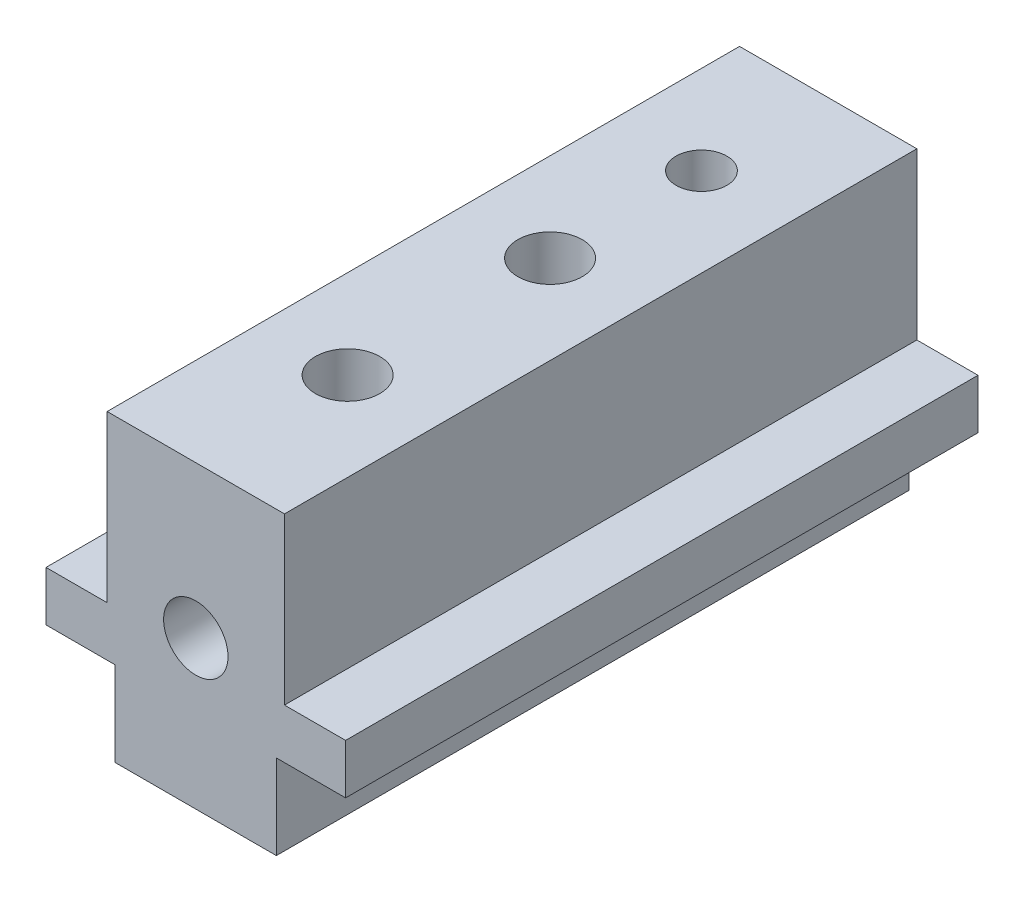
SolidWorks part; units mm, degrees
ref_plane "Front/Back" through (0, 0, 0) normal (0, 0, 1) x (1, 0, 0)
ref_plane "Top/Bottom" through (0, 0, 0) normal (0, 1, 0) x (1, 0, 0)
ref_plane "Right/Left" through (0, 0, 0) normal (1, 0, 0) x (0, 0, -1)
sketch "Sketch1" plane through (0, 0, 0) normal (0, 1, 0) x (1, 0, 0)
  line L0 (0, 0) -> (9.398, 0) construction
  line L1 (-9.398, 19.8374) -> (9.398, 19.8374)
  line L2 (-9.398, 19.8374) -> (-9.398, -19.8374)
  line L3 (-9.398, -19.8374) -> (9.398, -19.8374)
  line L4 (9.398, 19.8374) -> (9.398, -19.8374)
  line L5 (0, 0) -> (0, 19.8374) construction
  dimension "D1" = 18.796
  dimension "D2" = 39.6748
extrude "Extrude1" add sketch "Sketch1" along normal mid plane 18.8214
sketch "Sketch2" plane through (0, 0, 19.8374) normal (0, 0, 1) x (1, 0, 0)
  line L0 (0, 0) -> (10.5425, 0) construction
  line L1 (0, 0) -> (0, 10.0774) construction
  line L2 (-9.398, 9.4107) -> (9.398, 9.4107) construction
  line L3 (9.398, -4.1021) -> (9.398, -9.4107)
  line L4 (-5.5626, 9.4107) -> (-5.5626, -0.9779)
  line L5 (9.398, -9.4107) -> (5.0546, -9.4107)
  line L6 (5.5626, 9.4107) -> (5.5626, -0.9779)
  line L7 (-9.398, -9.4107) -> (9.398, -9.4107) construction
  line L8 (-9.398, 9.4107) -> (-9.398, -9.4107) construction
  line L9 (-9.398, -0.9779) -> (-5.5626, -0.9779)
  line L10 (9.398, -0.9779) -> (9.398, 9.4107)
  line L11 (-9.398, -4.1021) -> (-5.0546, -4.1021)
  line L12 (9.398, 9.4107) -> (5.5626, 9.4107)
  line L13 (9.398, 9.4107) -> (9.398, -9.4107) construction
  line L14 (5.5626, -0.9779) -> (9.398, -0.9779)
  line L15 (-5.0546, -4.1021) -> (-5.0546, -9.4107)
  line L16 (5.0546, -4.1021) -> (9.398, -4.1021)
  line L17 (5.0546, -4.1021) -> (5.0546, -9.4107)
  line L18 (-5.5626, 9.4107) -> (-9.398, 9.4107)
  line L19 (-9.398, 9.4107) -> (-9.398, -0.9779)
  line L20 (-9.398, -4.1021) -> (-9.398, -9.4107)
  line L21 (-9.398, -9.4107) -> (-5.0546, -9.4107)
  dimension "D1" = 10.3886
  dimension "D2" = 3.1242
  dimension "D3" = 11.1252
  dimension "D4" = 10.1092
extrude "Cut-Extrude1" cut sketch "Sketch2" against normal through all
hole_wizard "#10-32 (Finger Mount)" positions "Sketch4" profile "Sketch3" tap size "#10-32" standard "ANSI Inch"
sketch "Sketch4" plane through (0, 9.4107, 0) normal (0, 1, 0) x (-1, 0, 0)
  line L0 (0, 0) -> (0, 21.0974) construction
  line L1 (0, 0) -> (12.2736, 0) construction
  line L2 (9.398, 19.8374) -> (5.5626, 19.8374) construction
  line L3 (-5.5626, -19.8374) -> (5.5626, -19.8374) construction
  point P0 (0, 10.3124)
  point P1 (0, -2.3876)
  dimension "D1" = 9.525
  dimension "D2" = 12.7
  dimension "D3" = 17.4498
sketch "Sketch3" plane through (0, 9.4107, 10.3124) normal (1, 0, 0) x (0, 0, 1)
  line L0 (0, 0) -> (0, 13.1005)
  line L1 (0, 13.1005) -> (2.0193, 11.8872)
  line L2 (2.0193, 11.8872) -> (2.0193, 0)
  line L5 (2.0193, 0) -> (0, 0)
  line L10 (0, 13.1005) -> (-2.0193, 11.8872) construction
  line L11 (0, -6.35) -> (0, 107.95) construction
  dimension "Tap Drill Dia." = 4.0386
  dimension "Tap Drill Depth" = 11.8872
  dimension "Drill Angle" = 118
hole_wizard "#10-32 (Finger Mount )" positions "Sketch6" profile "Sketch5" tap size "#10-32" standard "Ansi Inch"
sketch "Sketch6" plane through (0, 0, 19.8374) normal (0, 0, 1) x (1, 0, 0)
  line L0 (0, 0) -> (0, 9.974) construction
  line L1 (0, -2.4765) -> (0, 9.4107) construction
  line L2 (0, 0) -> (9.5433, 0) construction
  line L3 (-5.5626, 9.4107) -> (5.5626, 9.4107) construction
  point P0 (0, -0.1143)
  dimension "D1" = 9.525
sketch "Sketch5" plane through (0, -0.1143, 19.8374) normal (1, 0, 0) x (0, -1, 0)
  line L0 (0, 0) -> (0, 13.1003)
  line L1 (0, 13.1003) -> (2.0193, 11.887)
  line L2 (2.0193, 11.887) -> (2.0193, 0)
  line L5 (2.0193, 0) -> (0, 0)
  line L10 (0, 13.1003) -> (-2.0193, 11.887) construction
  line L11 (0, -6.35) -> (0, 107.95) construction
  dimension "Tap Drill Dia." = 4.0386
  dimension "Tap Drill Depth" = 11.887
  dimension "Drill Angle" = 118
sketch "Sketch7" plane through (0, 9.4107, 0) normal (0, 1, 0) x (-1, 0, 0)
  line L0 (0, 0) -> (0, 21.0248) construction
  line L1 (0, 10.3124) -> (0, 19.8374) construction
  line L2 (-5.5626, -19.8374) -> (5.5626, -19.8374) construction
  circle A0 centre (0, -11.8872) radius 1.5939
  dimension "D1" = 3.1877
  dimension "D2" = 7.9502
extrude "(1/8 Dowel Slip Fit)" cut sketch "Sketch7" against normal blind 6.35
